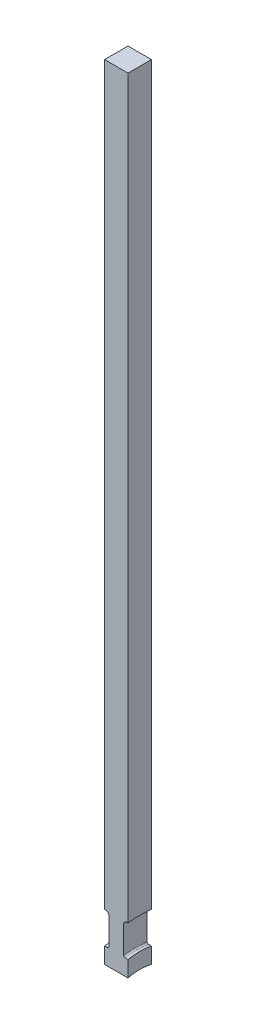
SolidWorks part; units mm, degrees
ref_plane "Front Plane" through (0, 0, 0) normal (0, 0, 1) x (1, 0, 0)
ref_plane "Top Plane" through (0, 0, 0) normal (0, 1, 0) x (1, 0, 0)
ref_plane "Right Plane" through (0, 0, 0) normal (1, 0, 0) x (0, 0, -1)
sketch "Sketch1" plane through (0, 0, 0) normal (1, 0, 0) x (0, 0, -1)
  line L0 (-3, 212) -> (-3, 0)
  line L1 (0, 249.2329) -> (0, 0) construction
  line L2 (3, 212) -> (3, 0)
  line L3 (-3, 212) -> (3, 212)
  line L6 (-3, 0) -> (3, 0)
  arc A0 (-12, 0) -> (12, 0) centre (0, 0) cw construction
  dimension "R" = 12
  dimension "L" = 200
  dimension "T" = 6
extrude "Boss-Extrude1" add sketch "Sketch1" along normal mid plane 6
sketch "Sketch8" plane through (0, 0, 0) normal (1, 0, 0) x (0, 0, -1)
  circle A0 centre (0, 0) radius 12
  arc A1 (12, 0) -> (-12, 0) centre (0, 0) ccw construction
extrude "Cut-Extrude4" cut sketch "Sketch8" against normal through all both and the other way through all
sketch "Sketch2" plane through (0, 0, 0) normal (0, 0, 1) x (1, 0, 0)
  line L0 (3, 16) -> (1.905, 16)
  line L1 (3, 212) -> (3, 11.619) construction
  line L2 (1.905, 16) -> (1.905, 24)
  line L3 (1.905, 24) -> (3, 24)
  line L4 (3, 24) -> (3, 16)
  line L5 (0, 29.9173) -> (0, 0) construction
  line L6 (-3, 24) -> (-3, 16)
  line L7 (-1.905, 24) -> (-3, 24)
  line L8 (-1.905, 16) -> (-1.905, 24)
  line L9 (-3, 16) -> (-1.905, 16)
  line L10 (-8.8482, 0) -> (24.5305, 0) construction
  dimension "D1" = 3.81
  dimension "D2" = 24
  dimension "D3" = 16
revolve "Cut-Revolve1" cut sketch "Sketch2" angle 360 about L10
fillet "Fillet1" radius 0.762 2 edges at (-1.905, 24, 0) (1.905, 24, 0)
fillet "Fillet2" radius 0.381 2 edges at (-1.905, 16, 0) (1.905, 16, 0)
